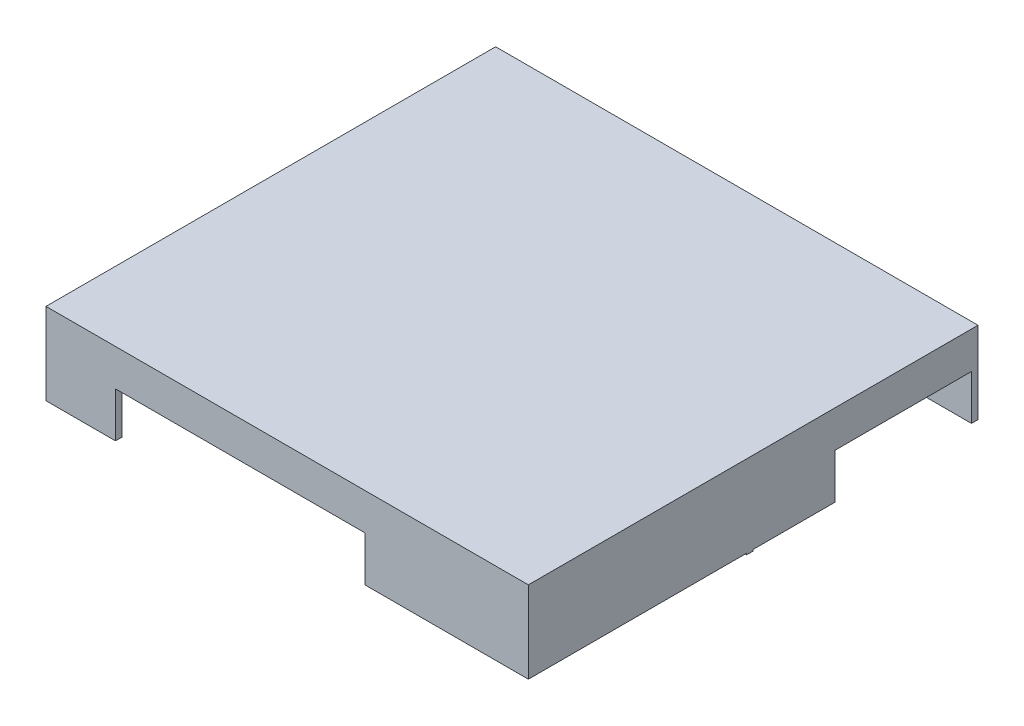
SolidWorks part; units mm, degrees
ref_plane "Front Plane" through (0, 0, 0) normal (0, 0, 1) x (1, 0, 0)
ref_plane "Top Plane" through (0, 0, 0) normal (0, 1, 0) x (1, 0, 0)
ref_plane "Right Plane" through (0, 0, 0) normal (1, 0, 0) x (0, 0, -1)
sketch "Sketch1" plane through (0, 0, 0) normal (0, 1, 0) x (1, 0, 0)
  line L1 (-7.493, 6.985) -> (7.493, 6.985)
  line L2 (-7.493, 6.985) -> (-7.493, -6.985)
  line L3 (-7.493, -6.985) -> (7.493, -6.985)
  line L4 (7.493, 6.985) -> (7.493, -6.985)
  point P4 (0, 6.985)
  point P6 (-7.493, 0)
  dimension "D1" = 14.986
  dimension "D2" = 13.97
extrude "Boss-Extrude1" add sketch "Sketch1" along normal blind 2.54
shell "Shell1" thickness 0.2032
sketch "Sketch2" plane through (0, 0, 0) normal (0, -1, 0) x (-1, 0, 0)
  line L0 (0, 0) -> (7.2898, 0) construction
  line L1 (7.2898, 6.7818) -> (7.2898, -6.7818) construction
  line L2 (0, 0) -> (-7.2898, 0) construction
  line L3 (-7.2898, -6.7818) -> (-7.2898, 6.7818) construction
  line L4 (0, 0) -> (0, 6.7818) construction
  line L5 (-7.2898, 6.7818) -> (7.2898, 6.7818) construction
  line L6 (7.493, 6.985) -> (7.493, -6.985) construction
  line L7 (7.2898, 0) -> (7.493, 0)
  line L8 (7.2898, 0) -> (7.2898, -0.2032)
  line L9 (7.2898, -0.2032) -> (7.493, -0.2032)
  line L10 (7.493, 0) -> (7.493, -0.2032)
  line L11 (-7.493, -6.985) -> (-7.493, 6.985) construction
  line L12 (-7.2898, 0) -> (-7.493, 0)
  line L13 (-7.2898, 0) -> (-7.2898, -0.2032)
  line L14 (-7.2898, -0.2032) -> (-7.493, -0.2032)
  line L15 (-7.493, 0) -> (-7.493, -0.2032)
  line L16 (-7.493, 6.985) -> (7.493, 6.985) construction
  line L17 (0, 6.7818) -> (0.2032, 6.7818)
  line L18 (0, 6.7818) -> (0, 6.985)
  line L19 (0, 6.985) -> (0.2032, 6.985)
  line L20 (0.2032, 6.7818) -> (0.2032, 6.985)
extrude "Boss-Extrude2" add sketch "Sketch2" along normal blind 0.045
sketch "Sketch3" plane through (7.493, 0, 0) normal (1, 0, 0) x (0, 0, -1)
  line L1 (6.7818, 0) -> (2.54, 0)
  line L2 (6.7818, 0) -> (6.7818, 1.397)
  line L3 (6.7818, 1.397) -> (2.54, 1.397)
  line L4 (2.54, 0) -> (2.54, 1.397)
  line L5 (-6.985, 2.54) -> (-6.985, 0) construction
  dimension "D1" = 9.525
  dimension "D2" = 1.397
extrude "Cut-Extrude1" cut sketch "Sketch3" against normal up to next
sketch "Sketch4" plane through (0, 0, -6.985) normal (0, 0, -1) x (-1, 0, 0)
  line L0 (-7.493, 0) -> (-7.493, 1.397) construction
  line L1 (7.2898, 0) -> (1.0414, 0)
  line L2 (7.2898, 0) -> (7.2898, 1.4)
  line L3 (7.2898, 1.4) -> (1.0414, 1.4)
  line L4 (1.0414, 0) -> (1.0414, 1.4)
  dimension "D1" = 1.4
  dimension "D2" = 8.5344
extrude "Cut-Extrude2" cut sketch "Sketch4" against normal up to next
sketch "Sketch5" plane through (-7.493, 0, 0) normal (-1, 0, 0) x (0, 0, 1)
  line L0 (-6.985, 0) -> (0, 0) construction
  line L1 (0.1524, 0) -> (6.785, 0)
  line L2 (0.1524, 0) -> (0.1524, 1.4)
  line L3 (0.1524, 1.4) -> (6.785, 1.4)
  line L4 (6.785, 0) -> (6.785, 1.4)
  line L5 (-6.985, 0) -> (-6.985, 1.4) construction
  line L6 (6.985, 2.54) -> (6.985, 0) construction
  dimension "D1" = 1.4
  dimension "D2" = 0.2
  dimension "D3" = 7.1374
extrude "Cut-Extrude4" cut sketch "Sketch5" against normal up to surface (0.2032 mm away)
sketch "Sketch6" plane through (0, 0, 6.985) normal (0, 0, 1) x (1, 0, 0)
  line L0 (-7.493, 0) -> (7.493, 0) construction
  line L1 (-5.334, 0) -> (2.413, 0)
  line L2 (-5.334, 0) -> (-5.334, 1.4)
  line L3 (-5.334, 1.4) -> (2.413, 1.4)
  line L4 (2.413, 0) -> (2.413, 1.4)
  line L5 (-7.493, 2.54) -> (-7.493, 0) construction
  dimension "D1" = 1.4
  dimension "D2" = 2.159
  dimension "D3" = 9.906
extrude "Cut-Extrude5" cut sketch "Sketch6" against normal up to next
